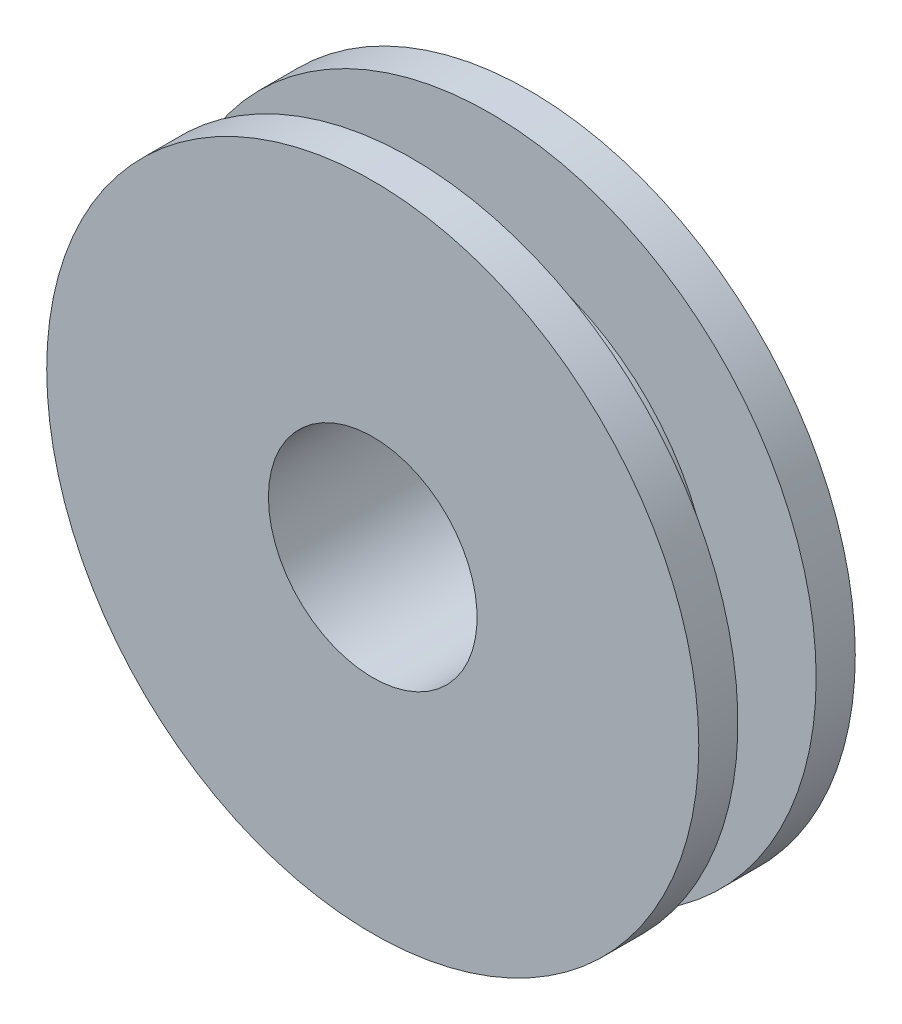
SolidWorks part; units mm, degrees
ref_plane "Plan1" through (0, 0, 0) normal (0, 0, 1) x (1, 0, 0)
ref_plane "Plan2" through (0, 0, 0) normal (0, 1, 0) x (1, 0, 0)
ref_plane "Plan3" through (0, 0, 0) normal (1, 0, 0) x (0, 0, -1)
sketch "diam" plane through (0, 0, 0) normal (0, 0, 1) x (1, 0, 0)
  circle A0 centre (0, 0) radius 12.5
  dimension "D1" = 25
extrude "cylindre" add sketch "diam" along normal blind 6
sketch "Esquisse3" plane through (0, 0, 0) normal (0, 1, 0) x (1, 0, 0)
  line L0 (8.5, -4.5) -> (13.5, -4.5)
  line L1 (8.5, -4.5) -> (8.5, -1.5)
  line L2 (13.5, -1.5) -> (8.5, -1.5)
  line L3 (13.5, -1.5) -> (13.5, -4.5)
  line L4 (0, 0) -> (0, -20) construction
  dimension "D1" = 5
  dimension "D2" = 3
  dimension "D3" = 8.5
  dimension "D4" = 4.5
revolve "gorge" cut sketch "Esquisse3" angle 360 about L4
sketch "Esquisse4" plane through (0, 0, 0) normal (0, 0, 1) x (1, 0, 0)
  circle A0 centre (0, 0) radius 6.5
  circle A1 centre (0, 0) radius 12.5 construction
  dimension "D1" = 13
extrude "bossage" add sketch "Esquisse4" against normal blind 0.5 draft 45
sketch "Esquisse7" plane through (0, 0, -0.5) normal (0, 0, -1) x (-1, 0, 0)
  circle A0 centre (0, 0) radius 4
  dimension "D1" = 8
extrude "perçage" cut sketch "Esquisse7" against normal through all
sketch "point d'encrage B" plane through (0, 0, -0.5) normal (0, 0, -1) x (-1, 0, 0)
  point P0 (0, 0)
sketch "point d'encrage A" plane through (0, 0, 6) normal (0, 0, 1) x (1, 0, 0)
  point P0 (0, 0)
